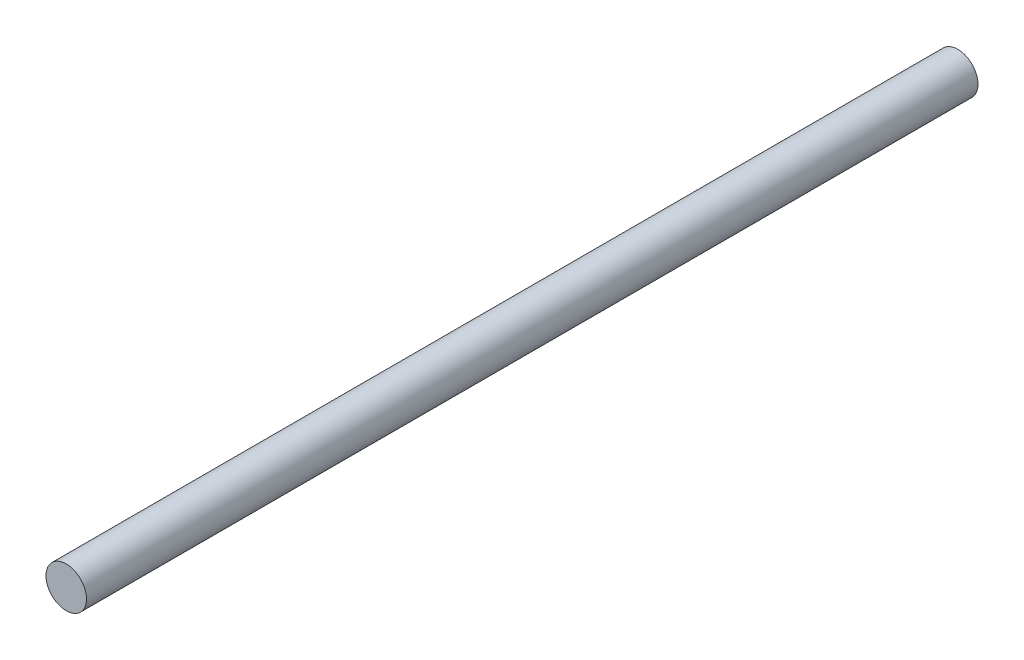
SolidWorks part; units mm, degrees
ref_plane "Plan de face" through (0, 0, 0) normal (0, 0, 1) x (1, 0, 0)
ref_plane "Plan de dessus" through (0, 0, 0) normal (0, 1, 0) x (1, 0, 0)
ref_plane "Plan de droite" through (0, 0, 0) normal (1, 0, 0) x (0, 0, -1)
sketch "Esquisse1" plane through (0, 0, 0) normal (0, 0, 1) x (1, 0, 0)
  circle A0 centre (0, 0) radius 5
  dimension "D1" = 10
extrude "Boss.-Extru.1" add sketch "Esquisse1" along normal blind 220
